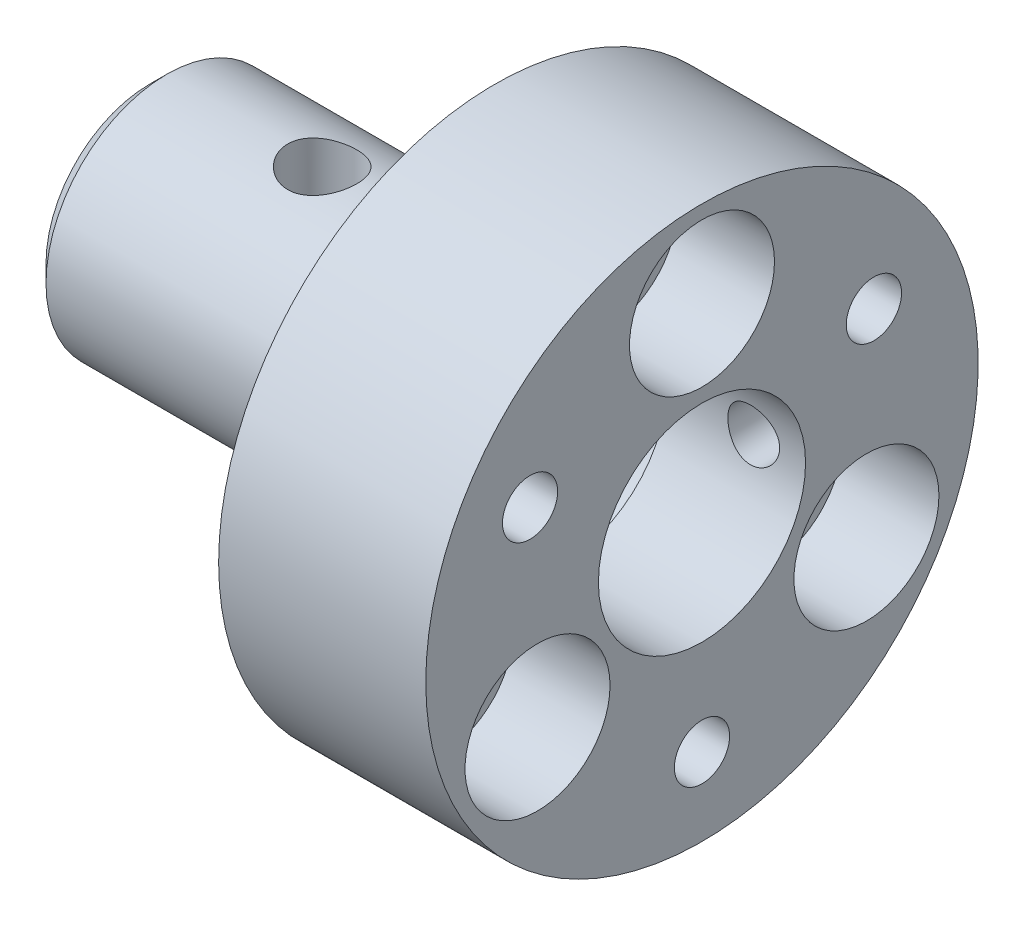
SolidWorks part; units mm, degrees
ref_plane "Vorne" through (0, 0, 0) normal (0, 0, 1) x (1, 0, 0)
ref_plane "Oben" through (0, 0, 0) normal (0, 1, 0) x (1, 0, 0)
ref_plane "Rechts" through (0, 0, 0) normal (1, 0, 0) x (0, 0, -1)
sketch "Skizze1" plane through (0, 0, 0) normal (0, 0, 1) x (1, 0, 0)
  line L18 (53.6147, 1.7) -> (53.6147, 2.2) construction
  line L19 (53.6147, 2.2) -> (51.6147, 2.2) construction
  line L20 (53.6147, 1.7) -> (53.6147, 2.2)
  line L21 (67.6147, 8) -> (67.6147, 3) construction
  line L22 (61.6147, 8) -> (67.6147, 8) construction
  line L23 (67.6147, 3) -> (63.6147, 3) construction
  line L24 (63.6147, 3) -> (63.6147, 3.25) construction
  line L25 (63.6147, 3.25) -> (62.6147, 3.25) construction
  line L26 (62.6147, 3.25) -> (62.6147, 2) construction
  line L27 (62.6147, 2) -> (60.6147, 2) construction
  line L28 (60.6147, 2) -> (60.6147, 1.7) construction
  line L29 (53.6147, 1.7) -> (60.6147, 1.7) construction
  line L30 (61.6147, 3.9) -> (61.6147, 8) construction
  line L31 (58.7147, 3.9) -> (61.6147, 3.9) construction
  line L32 (58.7147, 3.5) -> (58.7147, 3.9) construction
  line L33 (52.1147, 3.5) -> (58.7147, 3.5) construction
  line L34 (51.6147, 3) -> (52.1147, 3.5) construction
  line L35 (0, 0) -> (79.1682, 0) construction
  line L36 (0, 0) -> (79.1682, 0) construction
  line L37 (67.6147, 8) -> (67.6147, 3)
  line L38 (61.6147, 8) -> (67.6147, 8)
  line L39 (67.6147, 3) -> (63.6147, 3)
  line L40 (63.6147, 3) -> (63.6147, 3.25)
  line L41 (63.6147, 3.25) -> (62.6147, 3.25)
  line L42 (62.6147, 3.25) -> (62.6147, 2)
  line L43 (62.6147, 2) -> (60.6147, 2)
  line L44 (60.6147, 2) -> (60.6147, 1.7)
  line L45 (53.6147, 1.7) -> (60.6147, 1.7)
  line L46 (61.6147, 3.9) -> (61.6147, 8)
  line L47 (58.7147, 3.9) -> (61.6147, 3.9)
  line L48 (58.7147, 3.5) -> (58.7147, 3.9)
  line L49 (52.1147, 3.5) -> (58.7147, 3.5)
  line L50 (51.6147, 3) -> (52.1147, 3.5)
  line L51 (51.6147, 2.2) -> (51.6147, 3) construction
  line L52 (53.6147, 2.2) -> (51.6147, 2.2)
  line L53 (51.6147, 2.2) -> (51.6147, 3)
revolve "Rotation1" add sketch "Skizze1" angle 360 about L36
hole_wizard "Stirnsenkung für M2 Zylinderschraube mit Innensechskant1" positions "Skizze3" profile "Skizze2" counterbore size "M2" standard "ISO"
sketch "Skizze3" plane through (67.6147, 3.3493, 3.8464) normal (1, 0, 0) x (0, 0, -1)
  circle A0 centre (3.8464, -3.3493) radius 5.5 construction
  point P0 (3.8464, 2.1507)
  dimension "D1" = 11
sketch "Skizze2" plane through (67.6147, 5.5, 0) normal (0, 1, 0) x (0, 0, -1)
  line L0 (0, 0) -> (0, 16)
  line L1 (0, 16) -> (1.1, 16)
  line L3 (1.1, 16) -> (1.1, 2.8)
  line L4 (1.1, 2.8) -> (2.1, 2.8)
  line L5 (2.1, 2.8) -> (2.1, 0)
  line L7 (2.1, 0) -> (0, 0)
  line L11 (0, -6.35) -> (0, 107.95) construction
  dimension "Bohrerdurchmesser" = 2.2
  dimension "Bohrungstiefe" = 16
  dimension "Senkdurchmesser2" = 4.2
  dimension "Senktiefe2" = 2.8
hole_wizard "M2 Gewindebohrung1" positions "Skizze5" profile "Skizze4" tap size "M2" standard "ISO"
sketch "Skizze5" plane through (67.6147, 9.3333, 3.2779) normal (1, 0, 0) x (0, 0, -1)
  point P1 (3.2779, -15.0833)
  dimension "D1" = 5.75
sketch "Skizze4" plane through (67.6147, -5.75, 0) normal (0, 1, 0) x (0, 0, -1)
  line L0 (0, 0) -> (0, 16)
  line L1 (0, 16) -> (0.8, 16)
  line L2 (0.8, 16) -> (0.8, 0)
  line L5 (0.8, 0) -> (0, 0)
  line L11 (0, -6.35) -> (0, 107.95) construction
  dimension "Bohrerdurchmesser" = 1.6
  dimension "Bohrungstiefe" = 16
pattern_circular "Kreismuster1" count 3 over 360 about axis through (0, 0, 0) along (1, 0, 0) of "Stirnsenkung für M2 Zylinderschraube mit Innensechskant1", "M2 Gewindebohrung1"
sketch "Skizze7" plane through (0, 0, 0) normal (0, 0, 1) x (1, 0, 0)
  line L2 (67.6147, 0) -> (61.6147, 0) construction
  line L3 (67.6147, -8) -> (67.6147, 8) construction
  circle A0 centre (66.1147, 0) radius 0.75
  dimension "D1" = 1.5
  dimension "D2" = 1.5
extrude "Linear austragen2" cut sketch "Skizze7" against normal through all
sketch "Skizze8" plane through (0, 0, 0) normal (0, 1, 0) x (1, 0, 0)
  line L0 (67.6147, 1.4) -> (67.6147, -1.4) construction
  line L1 (61.6147, 0) -> (58.7147, 0) construction
  circle A0 centre (56.6147, 0) radius 1
  dimension "D1" = 2
  dimension "D2" = 11
extrude "Schnitt-Linear austragen1" cut sketch "Skizze8" against normal mid plane 8
sketch "Skizze9" plane through (58.7147, 0, 0) normal (-1, 0, 0) x (0, 0, 1)
  circle A0 centre (0, 0) radius 3.75
  dimension "D1" = 7.5
extrude "Linear austragen3" cut sketch "Skizze9" against normal up to surface (2.9 mm away) flip side to cut
